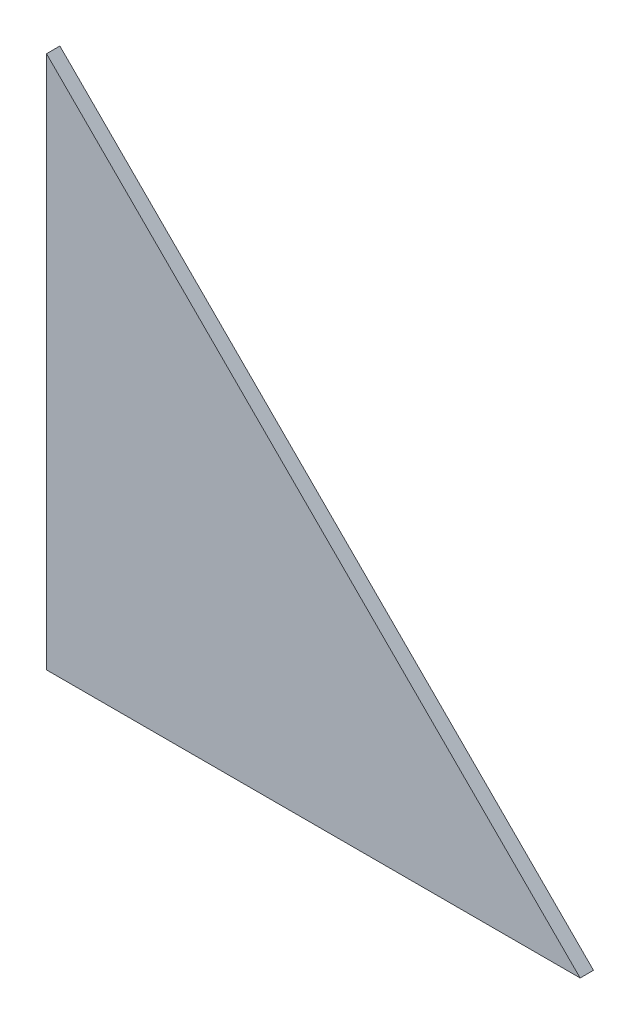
SolidWorks part; units mm, degrees
ref_plane "Piano frontale" through (0, 0, 0) normal (0, 0, 1) x (1, 0, 0)
ref_plane "Piano superiore" through (0, 0, 0) normal (0, 1, 0) x (1, 0, 0)
ref_plane "Piano destro" through (0, 0, 0) normal (1, 0, 0) x (0, 0, -1)
sketch "Schizzo1" plane through (0, 0, 0) normal (0, 0, 1) x (1, 0, 0)
  line L0 (0, 0) -> (0, 80)
  line L1 (0, 80) -> (80, 0)
  line L2 (80, 0) -> (0, 0)
  dimension "D1" = 80
  dimension "D2" = 80
extrude "Estrusione-Estrusione1" add sketch "Schizzo1" along normal blind 2 contours L0 L1 L2
